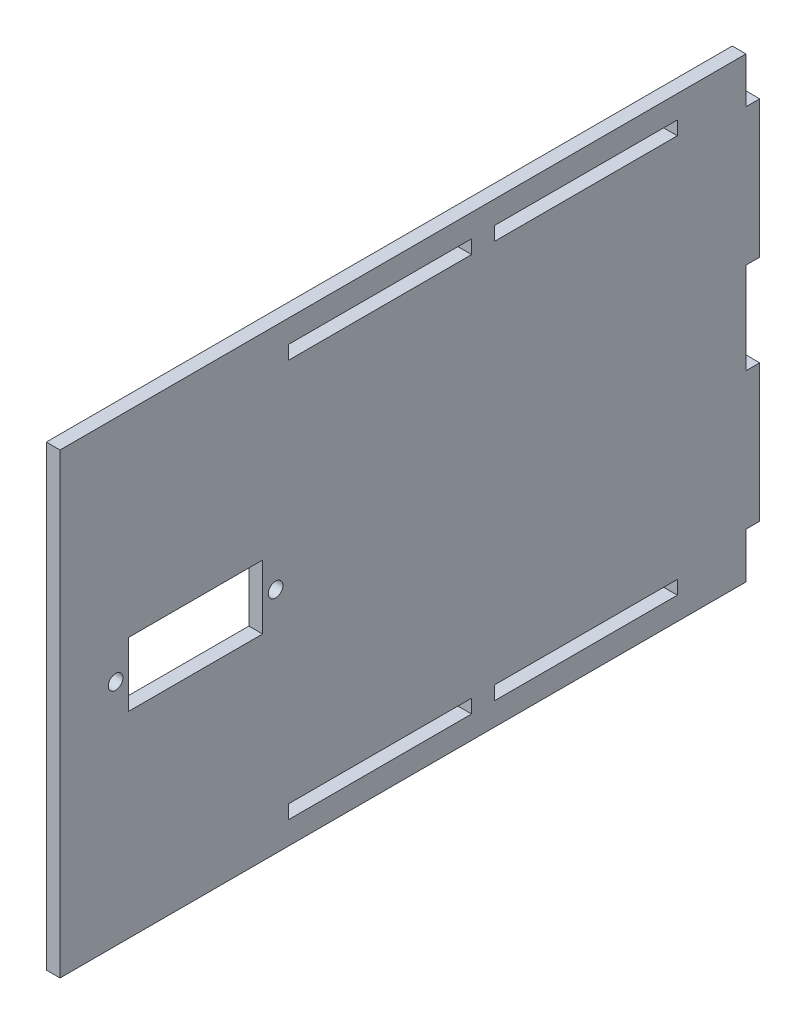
SolidWorks part; units mm, degrees
ref_plane "Plan de face" through (0, 0, 0) normal (0, 0, 1) x (1, 0, 0)
ref_plane "Plan de dessus" through (0, 0, 0) normal (0, 1, 0) x (1, 0, 0)
ref_plane "Plan de droite" through (0, 0, 0) normal (1, 0, 0) x (0, 0, -1)
sketch "Esquisse1" plane through (0, 0, 0) normal (0, 0, 1) x (1, 0, 0)
  line L0 (68.5, 40) -> (68.5, -40) construction
  line L1 (70, -50) -> (67, -50)
  line L2 (70, -50) -> (70, 50)
  line L3 (70, 50) -> (67, 50)
  line L4 (67, -50) -> (67, 50)
  line L5 (70, -50) -> (67, 50) construction
  line L6 (70, 50) -> (67, -50) construction
  line L7 (70, 40) -> (67, 40) construction
  line L8 (67, -40) -> (70, -40) construction
  line L10 (100, 50) -> (-100, 50) construction
  point P0 (68.5, 0)
  dimension "D1" = 3
extrude "Boss.-Extru.1" add sketch "Esquisse1" along normal blind 150
sketch "Esquisse2" plane through (0, 0, -3) normal (0, 0, -1) x (-1, 0, 0)
  line L0 (-67, 40) -> (-67, 10) construction
  line L1 (-70, 10) -> (-70, 40) construction
  line L2 (-70, 40) -> (-67, 40) construction
  line L3 (-67, 10) -> (-70, 10) construction
  line L4 (-67, -10) -> (-67, -40) construction
  line L5 (-70, -10) -> (-67, -10) construction
  line L6 (-70, -40) -> (-70, -10) construction
  line L7 (-67, -40) -> (-70, -40) construction
  line L8 (-67, 40) -> (-67, 10)
  line L9 (-70, 10) -> (-70, 40)
  line L10 (-70, 40) -> (-67, 40)
  line L11 (-67, 10) -> (-70, 10)
  line L12 (-67, -10) -> (-67, -40)
  line L13 (-70, -10) -> (-67, -10)
  line L14 (-70, -40) -> (-70, -10)
  line L15 (-67, -40) -> (-70, -40)
extrude "Boss.-Extru.2" add sketch "Esquisse2" against normal up to surface (3 mm away)
sketch "Esquisse3" plane through (70, 0, 0) normal (1, 0, 0) x (0, 0, -1)
  line L0 (-150, 0) -> (0, 0) construction
  line L1 (-150, -50) -> (-150, 50) construction
  line L2 (0, -10) -> (0, 10) construction
  line L3 (-120.35, 0) -> (-120.35, 12.1737) construction
  line L4 (-105.7, -7) -> (-135, -7)
  line L5 (-105.7, -7) -> (-105.7, 7)
  line L6 (-105.7, 7) -> (-135, 7)
  line L7 (-135, -7) -> (-135, 7)
  line L8 (-105.7, -7) -> (-135, 7) construction
  line L9 (-105.7, 7) -> (-135, -7) construction
  circle A0 centre (-137.85, 0) radius 1.6
  circle A1 centre (-102.85, 0) radius 1.6
  point P6 (-120.35, 0)
  dimension "D4" = 35
  dimension "D5" = 3.2
  dimension "D1" = 14
  dimension "D2" = 29.3
  dimension "D3" = 15
extrude "Enlèv. mat.-Extru.1" cut sketch "Esquisse3" against normal through all
sketch "Esquisse4" plane through (70, 0, 0) normal (1, 0, 0) x (0, 0, -1)
  line L0 (-150, 0) -> (-67.6436, 0) construction
  line L1 (-150, -50) -> (-150, 50) construction
  line L2 (-150, -50) -> (0, -50) construction
  line L3 (-100, -45) -> (-60, -45)
  line L4 (-100, -45) -> (-100, -42)
  line L5 (-100, -42) -> (-60, -42)
  line L6 (-60, -45) -> (-60, -42)
  line L7 (-100, -45) -> (-60, -42) construction
  line L8 (-100, -42) -> (-60, -45) construction
  line L9 (0, -50) -> (0, -40) construction
  line L10 (-100, 42) -> (-60, 45) construction
  line L11 (-100, 45) -> (-60, 42) construction
  line L12 (-60, 45) -> (-60, 42)
  line L13 (-100, 42) -> (-60, 42)
  line L14 (-100, 45) -> (-100, 42)
  line L15 (-100, 45) -> (-60, 45)
  line L16 (-55, -45) -> (-15, -45)
  line L17 (-55, -45) -> (-55, -42)
  line L18 (-55, -42) -> (-15, -42)
  line L19 (-15, -45) -> (-15, -42)
  line L20 (-55, -45) -> (-15, -42) construction
  line L21 (-55, -42) -> (-15, -45) construction
  line L22 (-15, 45) -> (-15, 42)
  line L23 (-55, 42) -> (-15, 42)
  line L24 (-55, 45) -> (-55, 42)
  line L25 (-55, 45) -> (-15, 45)
  line L26 (-55, 42) -> (-15, 45) construction
  line L27 (-55, 45) -> (-15, 42) construction
  point P5 (-80, -43.5)
  point P18 (-80, 43.5)
  point P20 (-35, -43.5)
  point P29 (-35, 43.5)
  dimension "D1" = 40
  dimension "D2" = 3
  dimension "D3" = 5
  dimension "D4" = 60
  dimension "D5" = 2
extrude "Enlèv. mat.-Extru.2" cut sketch "Esquisse4" against normal through all
